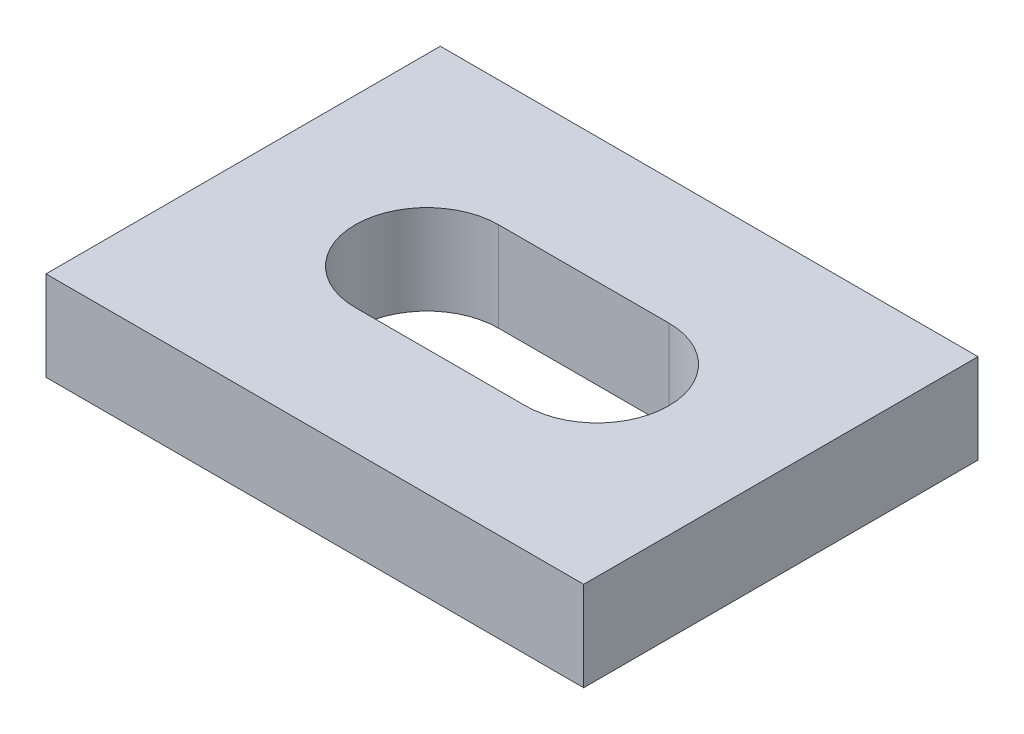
SolidWorks part; units mm, degrees
ref_plane "Plan de face" through (0, 0, 0) normal (0, 0, 1) x (1, 0, 0)
ref_plane "Plan de dessus" through (0, 0, 0) normal (0, 1, 0) x (1, 0, 0)
ref_plane "Plan de droite" through (0, 0, 0) normal (1, 0, 0) x (0, 0, -1)
sketch "Esquisse1" plane through (0, 0, 0) normal (0, 1, 0) x (1, 0, 0)
  line L1 (-30, -22) -> (30, -22)
  line L2 (-30, -22) -> (-30, 22)
  line L3 (-30, 22) -> (30, 22)
  line L4 (30, -22) -> (30, 22)
  point P4 (-30, 0)
  point P6 (0, 22)
  dimension "D1" = 44
  dimension "D2" = 60
extrude "Extrusion1" add sketch "Esquisse1" along normal blind 10
sketch "Esquisse2" plane through (-37.3097, 10, 5.9494) normal (0, 1, 0) x (-1, 0, 0)
  line L0 (-46.8097, -13.9494) -> (-27.8097, -13.9494)
  line L1 (-27.8097, 2.0506) -> (-46.8097, 2.0506)
  line L2 (-27.8097, -5.9494) -> (-46.8097, -5.9494) construction
  line L3 (-7.3097, 16.0506) -> (-67.3097, 16.0506) construction
  arc A0 (-27.8097, -13.9494) -> (-27.8097, 2.0506) centre (-27.8097, -5.9494) ccw
  arc A1 (-46.8097, 2.0506) -> (-46.8097, -13.9494) centre (-46.8097, -5.9494) ccw
  point P6 (-37.3097, -5.9494)
  dimension "LONGUEUR" = 35
  dimension "LARGEUR" = 16
extrude "Enlèv. mat.-Extru.1" cut sketch "Esquisse2" against normal up to next
other "OBLONG<1>"
ref_plane "Plan1" through (0, 0, 0) normal (-1, 0, 0) x (0, 0, 1)
